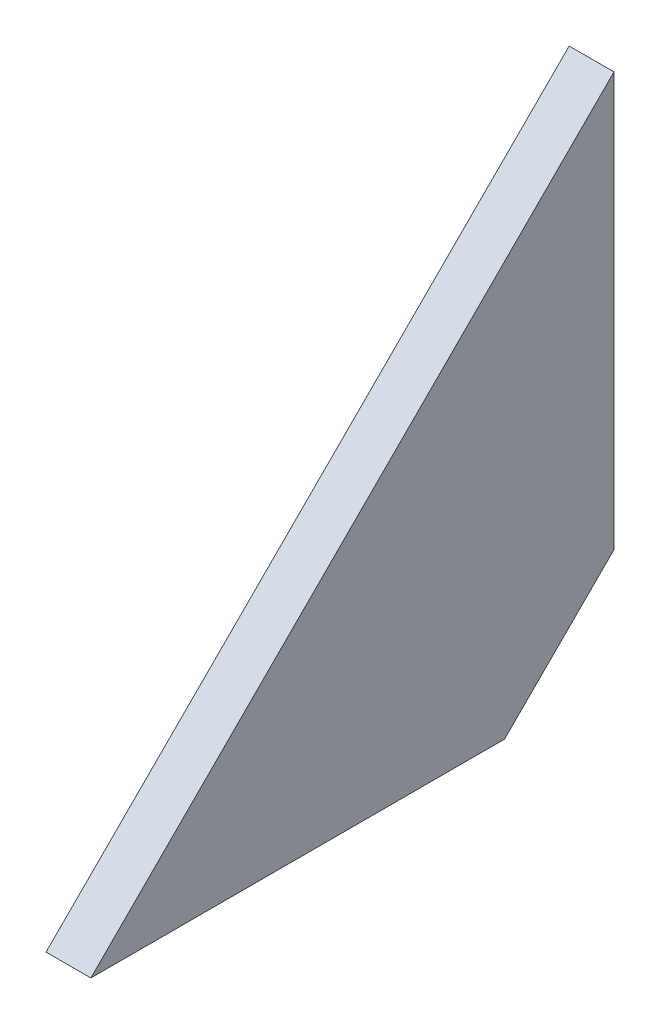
SolidWorks part; units mm, degrees
ref_plane "Face" through (0, 0, 0) normal (0, 0, 1) x (1, 0, 0)
ref_plane "Dessus" through (0, 0, 0) normal (0, 1, 0) x (1, 0, 0)
ref_plane "Droite" through (0, 0, 0) normal (1, 0, 0) x (0, 0, -1)
sketch "Esquisse1" plane through (0, 0, 0) normal (1, 0, 0) x (0, 0, -1)
  line L0 (0, 14.6447) -> (0, 70)
  line L1 (0, 70) -> (-70, 0)
  line L2 (-70, 0) -> (-14.6447, 0)
  line L3 (-14.6447, 0) -> (0, 14.6447)
  dimension "D1" = 70
  dimension "D2" = 70
  dimension "D3" = 55.3553
  dimension "D4" = 98.9949
extrude "Base-Extrusion" add sketch "Esquisse1" against normal blind 6
